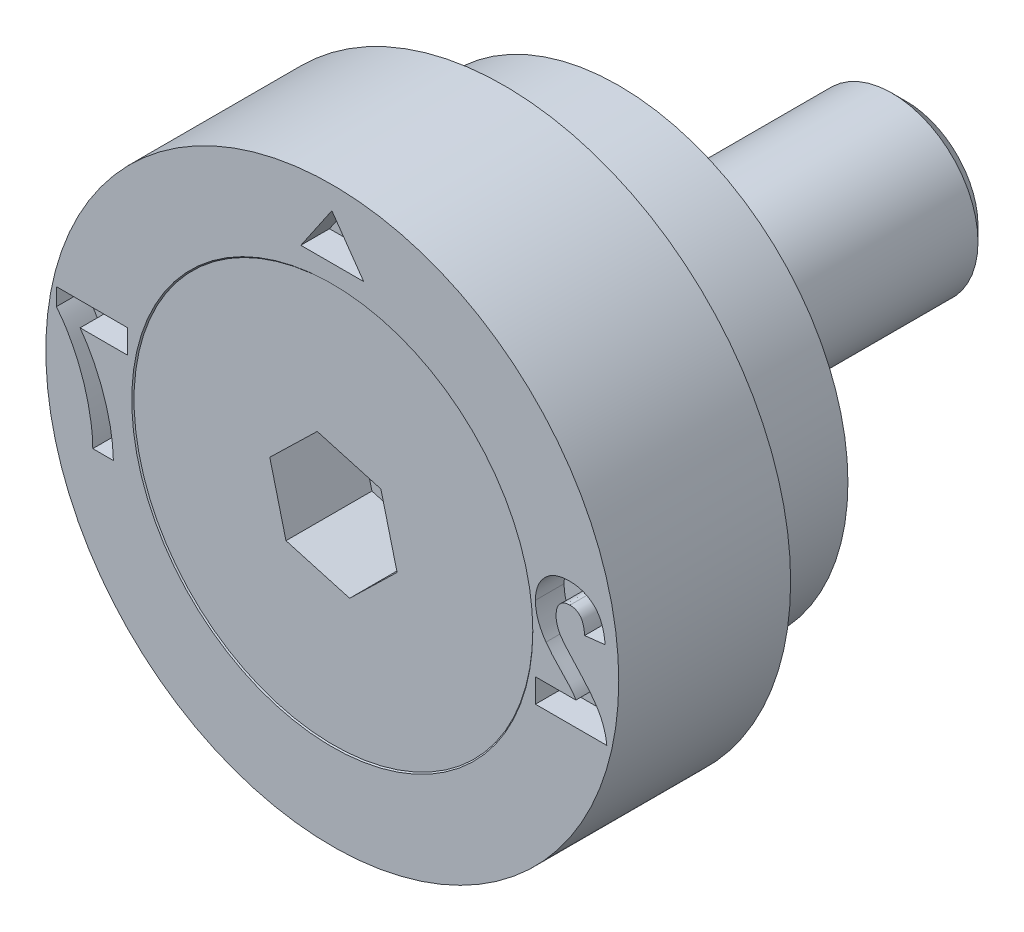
SolidWorks part; units mm, degrees
other "<M3 X .5 FHCS>-<Imported1>"
ref_plane "Front Plane" through (0, 0, 0) normal (0, 0, 1) x (1, 0, 0)
ref_plane "Top Plane" through (0, 0, 0) normal (0, 1, 0) x (1, 0, 0)
ref_plane "Right Plane" through (0, 0, 0) normal (1, 0, 0) x (0, 0, -1)
imported_body "Imported1"
sketch "Sketch1" plane through (0, 0, 0) normal (0, 0, 1) x (1, 0, 0)
  text T0 "2            7" font "Arial" height 2.159
  dimension "D1" = 1.0795
  dimension "D2" = 4.9022
extrude "Cut-Extrude1" cut sketch "Sketch1" against normal blind 0.5
inserted part "M3 X .5 FHCS"
move or copy body "Body-Move/Copy2" placed by mates yes
